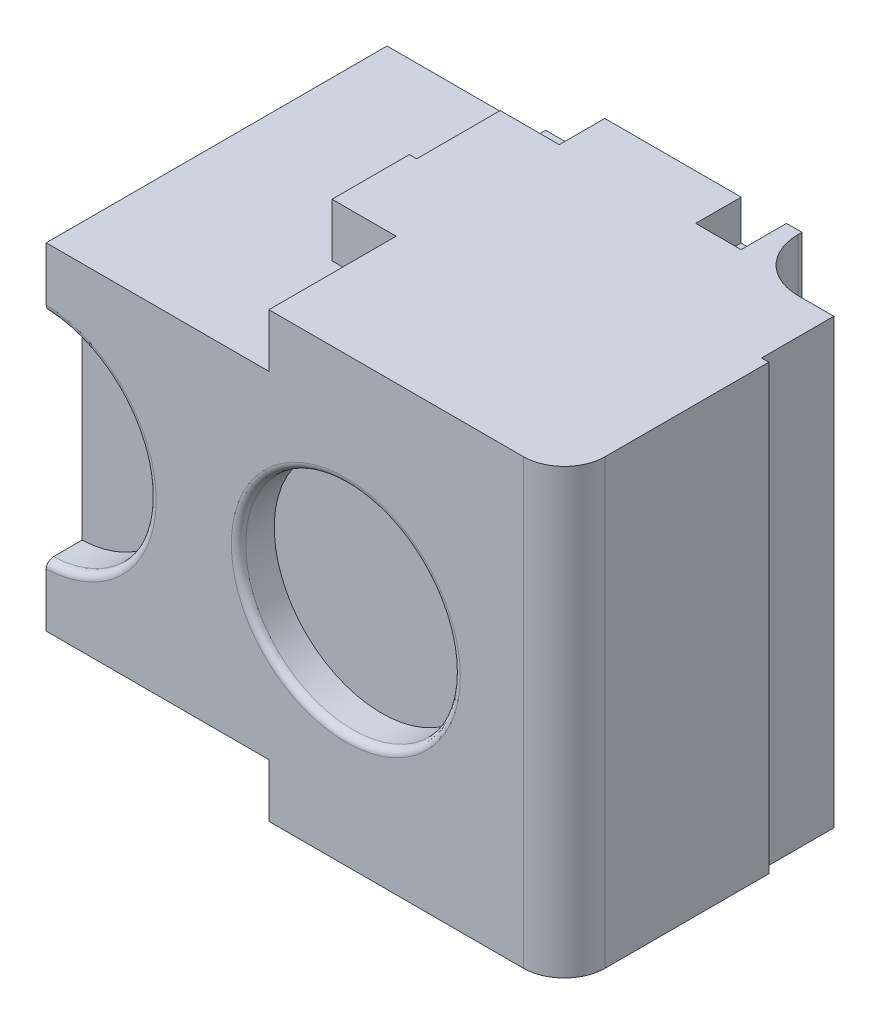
SolidWorks part; units mm, degrees
ref_plane "Front Plane" through (0, 0, 0) normal (0, 0, 1) x (1, 0, 0)
ref_plane "Top Plane" through (0, 0, 0) normal (0, 1, 0) x (1, 0, 0)
ref_plane "Right Plane" through (0, 0, 0) normal (1, 0, 0) x (0, 0, -1)
imported_body "Imported1"
sketch "Sketch1" plane through (0, 0, 146.05) normal (0, 0, 1) x (1, 0, 0)
  circle A0 centre (0, 0) radius 30
  circle A1 centre (85, 0) radius 30
  point P5 (0, 0)
  point P6 (85.6761, 0)
  dimension "D1" = 60
  dimension "D2" = 60
  dimension "D3" = 85
extrude "Cut-Extrude1" cut sketch "Sketch1" against normal blind 10
fillet "Fillet1" radius 2 2 edges at (115, 0, 146.05) (30, 0, 146.05)
